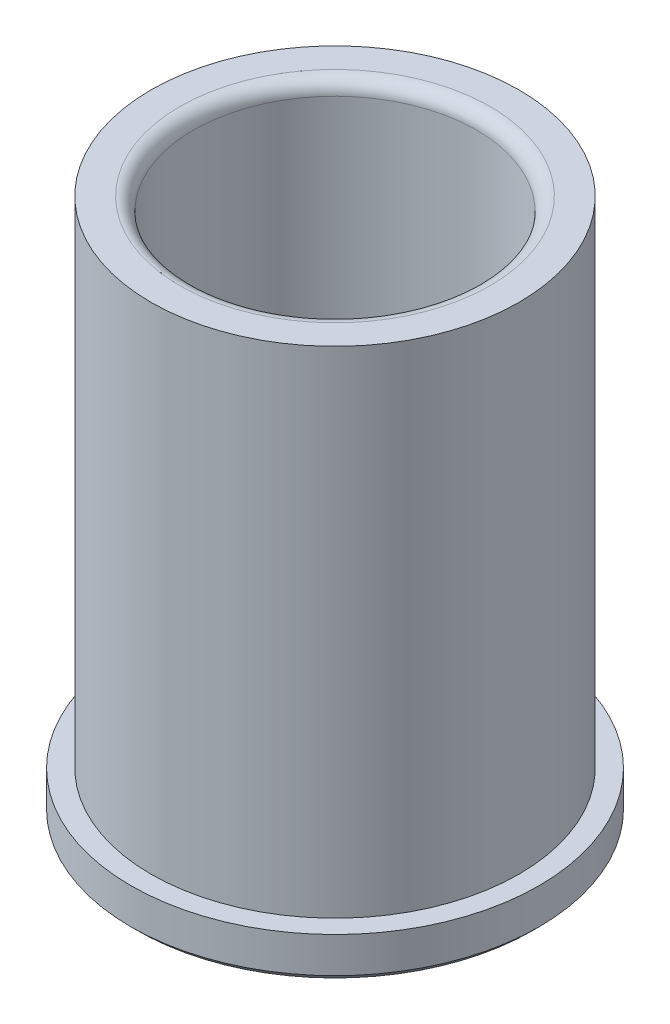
SolidWorks part; units mm, degrees
ref_plane "Front Plane" through (0, 0, 0) normal (0, 0, 1) x (1, 0, 0)
ref_plane "Top Plane" through (0, 0, 0) normal (0, 1, 0) x (1, 0, 0)
ref_plane "Right Plane" through (0, 0, 0) normal (1, 0, 0) x (0, 0, -1)
sketch "Sketch1" plane through (0, 0, 0) normal (0, 0, 1) x (1, 0, 0)
  line L0 (-22.1234, 0) -> (-22.8854, 0.762)
  line L1 (0, -1000) -> (0, 49000) construction
  line L2 (-15.8814, 60.325) -> (-15.8813, 0.762)
  line L3 (-16.6433, 0) -> (-22.1234, 0)
  line L4 (-22.8854, 0.762) -> (-22.8854, 4.7625)
  line L5 (-22.8854, 4.7625) -> (-20.6438, 4.7625)
  line L6 (-20.6438, 60.325) -> (-20.6438, 4.7625)
  line L7 (-20.6438, 60.325) -> (-15.8814, 60.325)
  line L8 (-16.6433, 0) -> (-15.8813, 0.762)
  dimension "OD" = 41.2877
  dimension "ID" = 31.7627
  dimension "H" = 45.7708
  dimension "D2" = 45
  dimension "OVERALL LENGTH" = 60.325
  dimension "D4" = 0.762
  dimension "D5" = 135
  dimension "T" = 4.7625
revolve "Revolve1" add sketch "Sketch1" angle 360 about L1
fillet "Fillet1" radius 1.524 1 edges at (15.8813, 60.325, 0)
